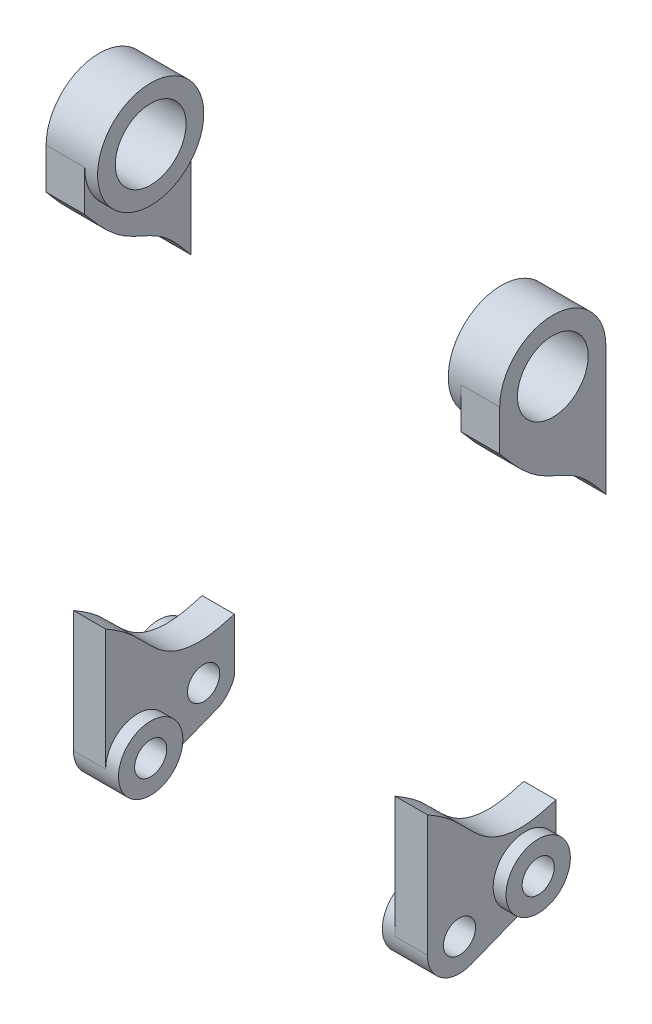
SolidWorks part; units mm, degrees
ref_plane "Face" through (0, 0, 0) normal (0, 0, 1) x (1, 0, 0)
ref_plane "Dessus" through (0, 0, 0) normal (0, 1, 0) x (1, 0, 0)
ref_plane "Droite" through (0, 0, 0) normal (1, 0, 0) x (0, 0, -1)
sketch "Esquisse1" plane through (0, 0, 0) normal (0, 0, 1) x (1, 0, 0)
  line L0 (58.5, 28.5) -> (58.5, 90)
  line L1 (58.5, 90) -> (70.5, 90)
  line L2 (70.5, 90) -> (70.5, 22.0147)
  line L3 (64.6421, 7.8726) -> (46.6274, -10.1421)
  line L4 (32.4853, -16) -> (0, -16)
  line L5 (0, -16) -> (0, 0)
  line L6 (0, 0) -> (30, 0)
  line L7 (37.0711, 2.9289) -> (55.5711, 21.4289)
  arc A0 (55.5711, 21.4289) -> (58.5, 28.5) centre (48.5, 28.5) ccw
  arc A1 (30, 0) -> (37.0711, 2.9289) centre (30, 10) ccw
  arc A2 (70.5, 22.0147) -> (64.6421, 7.8726) centre (50.5, 22.0147) cw
  arc A3 (46.6274, -10.1421) -> (32.4853, -16) centre (32.4853, 4) cw
  dimension "D4" = 10
  dimension "D5" = 20
  dimension "D1" = 12
  dimension "D2" = 16
  dimension "D3" = 16
  dimension "D6" = 58.5
  dimension "D7" = 30
  dimension "D8" = 135
  dimension "D9" = 90
extrude "Base-Extrusion" add sketch "Esquisse1" along normal mid plane 40
sketch "Esquisse2" plane through (70.5, 0, 0) normal (1, 0, 0) x (0, 0, -1)
  line L0 (-13, 90) -> (-13, 74.1421)
  line L1 (-15.9289, 67.0711) -> (-17.0711, 65.9289)
  line L2 (-20, 58.8579) -> (-20, 16.5)
  line L3 (-20, 22.0147) -> (-20, 90) construction
  line L4 (-20, 16.5) -> (-30, 16.5)
  line L5 (-30, 16.5) -> (-30, 90)
  line L6 (-30, 90) -> (-13, 90)
  line L7 (20, 22.0147) -> (20, 90) construction
  line L8 (-20, 90) -> (20, 90) construction
  arc A0 (-13, 74.1421) -> (-15.9289, 67.0711) centre (-23, 74.1421) cw
  arc A1 (-17.0711, 65.9289) -> (-20, 58.8579) centre (-10, 58.8579) ccw
  point P14 (-13, 70)
  point P17 (-20, 63)
  dimension "D4" = 10
  dimension "D1" = 33
  dimension "D2" = 20
  dimension "D3" = 135
extrude "Enlèv. mat.-Extru.1" cut sketch "Esquisse2" against normal through all
sketch "Esquisse4" plane through (70.5, 0, 0) normal (1, 0, 0) x (0, 0, -1)
  line L1 (-13, 90) -> (20, 90) construction
  circle A0 centre (3.5, 90) radius 16.5
  dimension "D1" = 33
extrude "Boss.-Extru.1" add sketch "Esquisse4" against normal blind 16
sketch "Esquisse6" plane through (0, 0, 20) normal (0, 0, 1) x (1, 0, 0)
  line L0 (0, -16) -> (32.4853, -16)
  line L1 (46.6274, -10.1421) -> (64.6421, 7.8726) construction
  line L2 (55, -1.7696) -> (51.6824, -1.6099)
  line L3 (55, -1.7696) -> (55, -24)
  line L4 (0, -16) -> (0, -24)
  line L5 (0, -24) -> (55, -24)
  line L6 (0, -16) -> (32.4853, -16) construction
  arc A0 (32.4853, -16) -> (46.6274, -10.1421) centre (32.4853, 4) ccw construction
  arc A1 (51.6824, -1.6099) -> (32.4853, -16) centre (32.4853, 4) cw
  dimension "D1" = 55
  dimension "D2" = 8
extrude "Boss.-Extru.4" add sketch "Esquisse6" against normal blind 10
fillet "Congé1" radius 3
sketch "Esquisse15" plane through (55, 0, 0) normal (1, 0, 0) x (0, 0, -1)
  line L0 (-20, -1.7696) -> (20, -1.7696)
  line L1 (20, -1.7696) -> (20, -56.7696)
  line L2 (-20, -1.7696) -> (-20, -61.7696)
  line L3 (-6.3248, -71.0697) -> (15.277, -62.5333)
  line L4 (-10, -16) -> (20, -16) construction
  line L5 (-20, 22.0147) -> (-20, 7.8726) construction
  line L6 (20, 7.8726) -> (20, 22.0147) construction
  arc A0 (-6.3248, -71.0697) -> (-20, -61.7696) centre (-10, -61.7696) cw
  arc A1 (20, -56.7696) -> (15.277, -62.5333) centre (10.4606, -53.7696) cw
  dimension "D1" = 60
  dimension "D3" = 10
  dimension "D4" = 10
  dimension "D2" = 55
  dimension "D5" = 14.2304
  dimension "D7" = 52
extrude "Boss.-Extru.5" add sketch "Esquisse15" against normal blind 10
sketch "Esquisse17" plane through (45, 0, 0) normal (-1, 0, 0) x (0, 0, 1)
  circle A0 centre (10, -61.7696) radius 10
extrude "Boss.-Extru.6" add sketch "Esquisse17" along normal blind 4
sketch "Esquisse18" plane through (55, 0, 0) normal (1, 0, 0) x (0, 0, -1)
  circle A0 centre (10.4606, -53.7696) radius 10
extrude "Boss.-Extru.7" add sketch "Esquisse18" along normal blind 4
mirror "Symétrie1"
sketch "Esquisse16" plane through (55, 0, 0) normal (1, 0, 0) x (0, 0, -1)
  circle A0 centre (10.4606, -53.7696) radius 5
  circle A1 centre (-10, -61.7696) radius 5
  dimension "D1" = 10
  dimension "D2" = 10
extrude "Enlèv. mat.-Extru.5" cut sketch "Esquisse16" against normal mid plane 400
sketch "Esquisse19" plane through (70.5, 0, 0) normal (1, 0, 0) x (0, 0, -1)
  circle A0 centre (3.5, 90) radius 11
  dimension "D1" = 22
extrude "Enlèv. mat.-Extru.6" cut sketch "Esquisse19" against normal through all
sketch "Esquisse20" plane through (-70.5, 0, 0) normal (-1, 0, 0) x (0, 0, 1)
  line L0 (13, 74.1421) -> (13, 90) construction
  line L1 (-20, 22.0147) -> (-20, 90) construction
  line L2 (-20, -50.7696) -> (-20, -1.7696) construction
  line L3 (13, 77.3407) -> (26.2459, 77.3407)
  line L4 (26.2459, 77.3407) -> (26.2459, -24)
  line L5 (20, -24) -> (26.2459, -24)
  line L6 (-20, 50) -> (-30, 50)
  line L7 (-30, 50) -> (-30, -40)
  line L8 (-30, -40) -> (-20, -40)
  line L9 (20, -61.7696) -> (20, -1.7696) construction
  point P1 (0, 65)
  point P4 (-10, 60)
  point P9 (-10, -42)
  point P12 (0, -40)
  point P13 (13, -28.7076)
extrude "Enlèv. mat.-Extru.7" cut sketch "Esquisse20" against normal through all
